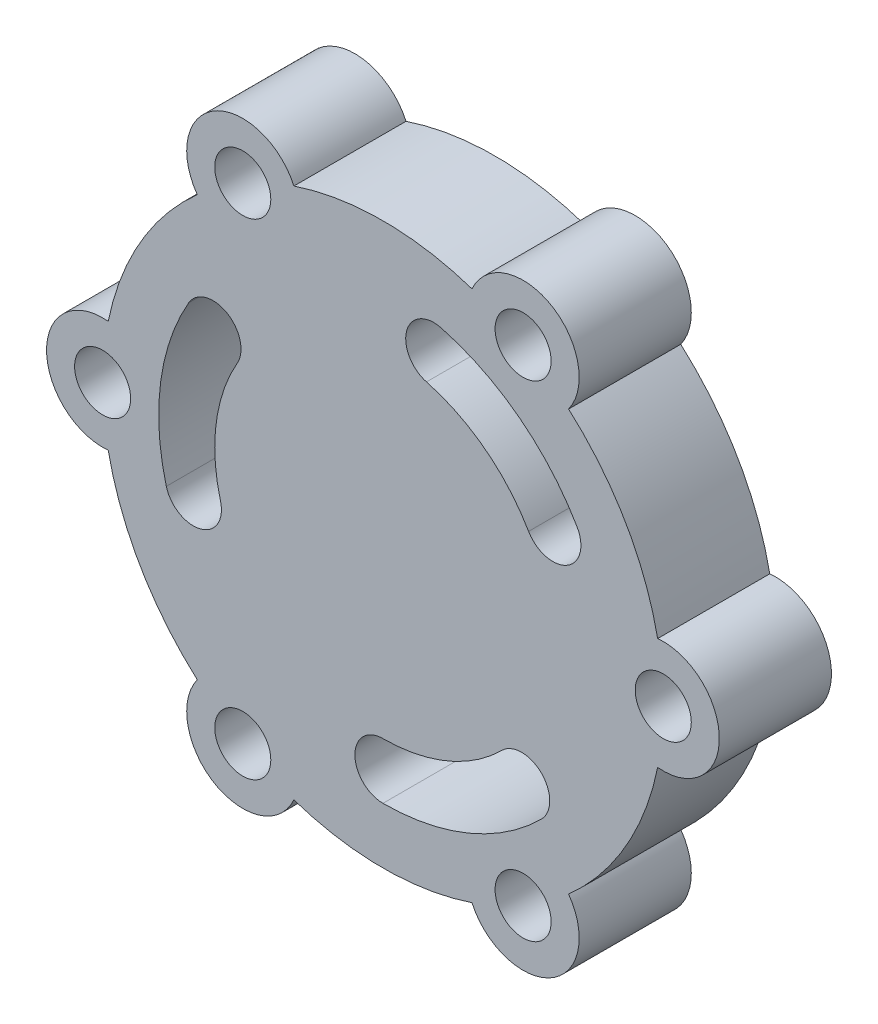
SolidWorks part; units mm, degrees
ref_plane "Front Plane" through (0, 0, 0) normal (0, 0, 1) x (1, 0, 0)
ref_plane "Top Plane" through (0, 0, 0) normal (0, 1, 0) x (1, 0, 0)
ref_plane "Right Plane" through (0, 0, 0) normal (1, 0, 0) x (0, 0, -1)
sketch "Sketch1" plane through (0, 0, 0) normal (0, 0, 1) x (1, 0, 0)
  line L0 (70, 70) -> (79.0587, 103.8074) construction
  line L1 (70, 70) -> (100.3109, 87.5) construction
  line L2 (120, 70) -> (130, 70) construction
  arc A0 (36.8832, 107.4603) -> (21, 79.9499) centre (70, 70) ccw
  arc A1 (119, 60.0501) -> (119, 79.9499) centre (120, 70) ccw
  arc A2 (85.8832, 22.5898) -> (103.1168, 32.5397) centre (95, 26.6987) ccw
  arc A3 (36.8832, 32.5397) -> (54.1168, 22.5898) centre (45, 26.6987) ccw
  arc A4 (21, 79.9499) -> (21, 60.0501) centre (20, 70) ccw
  arc A5 (54.1168, 117.4102) -> (36.8832, 107.4603) centre (45, 113.3013) ccw
  arc A6 (103.1168, 107.4603) -> (85.8832, 117.4102) centre (95, 113.3013) ccw
  arc A7 (85.8832, 117.4102) -> (54.1168, 117.4102) centre (70, 70) ccw
  arc A8 (119, 79.9499) -> (103.1168, 107.4603) centre (70, 70) ccw
  arc A9 (103.1168, 32.5397) -> (119, 60.0501) centre (70, 70) ccw
  arc A10 (54.1168, 22.5898) -> (85.8832, 22.5898) centre (70, 70) ccw
  arc A11 (21, 60.0501) -> (36.8832, 32.5397) centre (70, 70) ccw
  arc A12 (100.3109, 87.5) -> (79.0587, 103.8074) centre (70, 70) ccw construction
  arc A13 (104.641, 90) -> (80.3528, 108.637) centre (70, 70) ccw
  arc A14 (95.9808, 85) -> (77.7646, 98.9778) centre (70, 70) ccw
  arc A15 (95.9808, 85) -> (104.641, 90) centre (100.3109, 87.5) ccw
  arc A16 (80.3528, 108.637) -> (77.7646, 98.9778) centre (79.0587, 103.8074) ccw
  arc A17 (70, 35) -> (94.7487, 45.2513) centre (70, 70) ccw construction
  arc A18 (70, 30) -> (98.2843, 41.7157) centre (70, 70) ccw
  arc A19 (70, 40) -> (91.2132, 48.7868) centre (70, 70) ccw
  arc A20 (70, 40) -> (70, 30) centre (70, 35) ccw
  arc A21 (98.2843, 41.7157) -> (91.2132, 48.7868) centre (94.7487, 45.2513) ccw
  arc A22 (39.6891, 87.5) -> (36.1926, 60.9413) centre (70, 70) ccw construction
  arc A23 (35.359, 90) -> (31.363, 59.6472) centre (70, 70) ccw
  arc A24 (44.0192, 85) -> (41.0222, 62.2354) centre (70, 70) ccw
  arc A25 (44.0192, 85) -> (35.359, 90) centre (39.6891, 87.5) ccw
  arc A26 (31.363, 59.6472) -> (41.0222, 62.2354) centre (36.1926, 60.9413) ccw
  circle A27 centre (20, 70) radius 5
  circle A28 centre (45, 113.3013) radius 5
  circle A29 centre (95, 113.3013) radius 5
  circle A30 centre (120, 70) radius 5
  circle A31 centre (95, 26.6987) radius 5
  circle A32 centre (45, 26.6987) radius 5
  point P6 (91.3067, 97.7674)
  point P23 (70, 70)
  point P37 (83.3939, 37.6642)
  point P44 (35.2994, 74.5684)
  point P49 (70, 70)
  dimension "D1" = 70
  dimension "D3" = 50
  dimension "D5" = 10
  dimension "D8" = 70
  dimension "D10" = 10
  dimension "D2" = 70
  dimension "D6" = 30
  dimension "D9" = 10
  dimension "D7" = 45
  dimension "D4" = 6
  dimension "D11" = 6
extrude "Boss-Extrude1" add sketch "Sketch1" along normal blind 20
